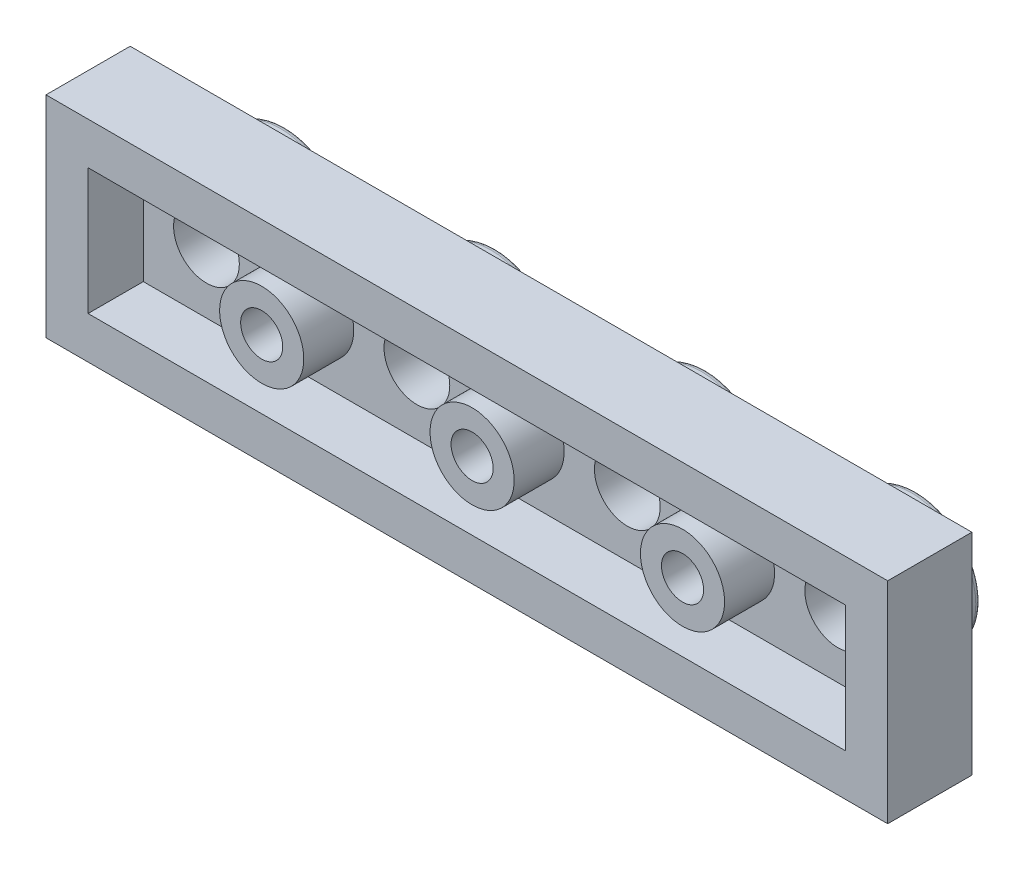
SolidWorks part; units mm, degrees
ref_plane "Vorne" through (0, 0, 0) normal (0, 0, 1) x (1, 0, 0)
ref_plane "Oben" through (0, 0, 0) normal (0, 1, 0) x (1, 0, 0)
ref_plane "Rechts" through (0, 0, 0) normal (1, 0, 0) x (0, 0, -1)
sketch "Skizze1" plane through (0, 0, 0) normal (0, 0, 1) x (1, 0, 0)
  line L1 (0, 0) -> (-32, 0)
  line L2 (0, 0) -> (0, -8)
  line L3 (0, -8) -> (-32, -8)
  line L4 (-32, 0) -> (-32, -8)
  dimension "D1" = 32
  dimension "D2" = 8
extrude "Linear austragen1" add sketch "Skizze1" along normal blind 3.2
sketch "Skizze2" plane through (0, 0, 3.2) normal (0, 0, 1) x (1, 0, 0)
  line L0 (-32, -8) -> (0, -8) construction
  line L1 (-1.6, -6.4) -> (-30.4, -6.4)
  line L2 (-1.6, -6.4) -> (-1.6, -1.6)
  line L3 (0, 0) -> (-32, 0) construction
  line L4 (-30.4, -6.4) -> (-30.4, -1.6)
  line L5 (0, -8) -> (0, 0) construction
  line L6 (-32, 0) -> (-32, -8) construction
  line L7 (-1.6, -1.6) -> (-30.4, -1.6)
  dimension "D1" = 1.6
  dimension "D2" = 1.6
  dimension "D3" = 1.6
  dimension "D4" = 1.6
extrude "Schnitt-Linear austragen1" cut sketch "Skizze2" against normal blind 2.1
sketch "Skizze3" plane through (0, 0, 1.1) normal (0, 0, 1) x (1, 0, 0)
  line L0 (0, -8) -> (0, 0) construction
  line L1 (0, 0) -> (-32, 0) construction
  circle A0 centre (-8, -4) radius 1.6
  circle A1 centre (-8, -4) radius 0.8
  dimension "D1" = 3.2
  dimension "D2" = 1.6
  dimension "D4" = 4
  dimension "D3" = 8
extrude "Linear austragen2" add sketch "Skizze3" along normal blind 1.9
sketch "Skizze4" plane through (0, 0, 0) normal (0, 0, -1) x (-1, 0, 0)
  line L0 (0, 0) -> (32, 0) construction
  line L1 (0, -8) -> (0, 0) construction
  circle A0 centre (4, -4) radius 2.45
  dimension "D1" = 4.9
  dimension "D2" = 4
  dimension "D3" = 4
extrude "Linear austragen3" add sketch "Skizze4" along normal blind 1.9
fillet "Verrundung1" radius 0.2 1 edges at (-6.45, -4, -1.9)
sketch "Skizze9" plane through (0, 0, 1.1) normal (0, 0, 1) x (1, 0, 0)
  line L0 (-32, -8) -> (0, -8) construction
  line L1 (0, -8) -> (0, 0) construction
  circle A0 centre (-4, -4) radius 1.25
  dimension "D1" = 2.5
  dimension "D2" = 4
  dimension "D3" = 4
extrude "Schnitt-Linear austragen2" cut sketch "Skizze9" against normal blind 1.8
pattern_linear "Lineares Muster2" count 3 spacing 8 along (-1, 0, 0) of "Linear austragen2"
pattern_linear "Lineares Muster3" count 4 spacing 8 along (-1, 0, 0) of "Schnitt-Linear austragen2", "Verrundung1", "Linear austragen3"
